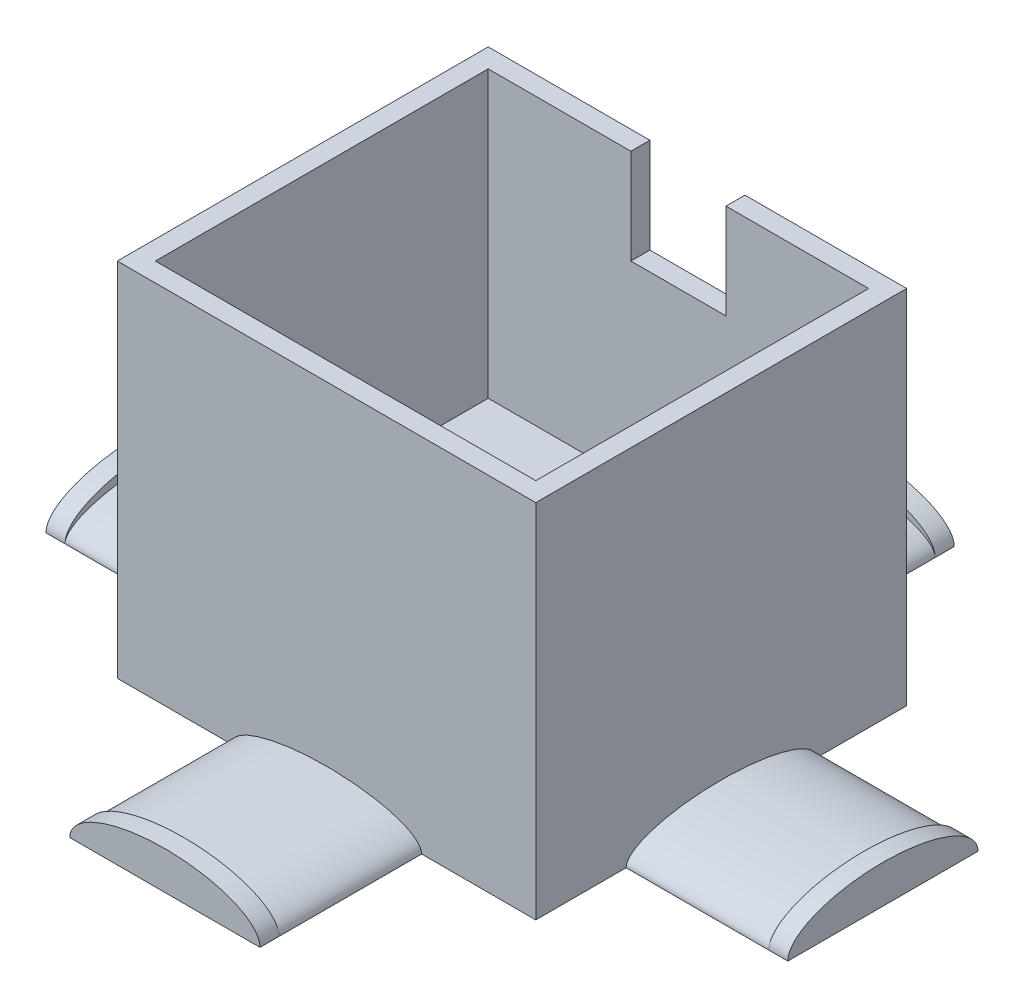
SolidWorks part; units mm, degrees
ref_plane "Front Plane" through (0, 0, 0) normal (0, 0, 1) x (1, 0, 0)
ref_plane "Top Plane" through (0, 0, 0) normal (0, 1, 0) x (1, 0, 0)
ref_plane "Right Plane" through (0, 0, 0) normal (1, 0, 0) x (0, 0, -1)
sketch "Sketch1" plane through (0, 0, 0) normal (0, 1, 0) x (1, 0, 0)
  line L1 (0, 0) -> (-44, 0)
  line L2 (0, 0) -> (0, 39)
  line L3 (0, 39) -> (-44, 39)
  line L4 (-44, 0) -> (-44, 39)
  dimension "D1" = 39
  dimension "D2" = 44
extrude "Boss-Extrude1" add sketch "Sketch1" along normal blind 32
shell "Shell1" thickness 2
sketch "Sketch2" plane through (0, 0, 0) normal (0, -1, 0) x (1, 0, 0)
  line L1 (-44, 0) -> (0, 0)
  line L2 (-44, 0) -> (-44, -39)
  line L3 (-44, -39) -> (0, -39)
  line L4 (0, 0) -> (0, -39)
extrude "Boss-Extrude2" add sketch "Sketch2" along normal blind 6
sketch "Sketch3" plane through (0, 2, 0) normal (0, 1, 0) x (1, 0, 0)
  line L0 (-22, 37) -> (-22, 27)
  line L1 (-2, 37) -> (-42, 37) construction
  line L2 (-11.205, 27) -> (-32.795, 27)
  line L5 (-32.795, 11.76) -> (-32.795, 27)
  line L6 (-32.795, 11.76) -> (-11.205, 11.76)
  line L7 (-11.205, 11.76) -> (-11.205, 27)
  circle A0 centre (-32.795, 27) radius 1.6
  circle A1 centre (-11.205, 27) radius 1.6
  circle A2 centre (-11.205, 11.76) radius 1.6
  circle A3 centre (-32.795, 11.76) radius 1.6
  point P4 (-22, 29.54)
  point P7 (-22, 27)
  point P14 (-32.795, 19.38)
  dimension "D3" = 3.2
  dimension "D4" = 3.2
  dimension "D5" = 3.2
  dimension "D6" = 3.2
  dimension "D1" = 21.59
  dimension "D2" = 15.24
  dimension "D7" = 10
  dimension "D8" = 2.54
extrude "Cut-Extrude1" cut sketch "Sketch3" against normal through all contours L2 A0 L5 | L5 A0 L2 | L2 A1 L7 | L7 A1 L2 | L7 A2 L6 | L6 A2 L7 | L5 A3 L6 | L6 A3 L5
sketch "Sketch5" plane through (0, 2, 0) normal (0, 1, 0) x (1, 0, 0)
  line L0 (-42, 2) -> (-42, 19)
  line L1 (-42, 37) -> (-42, 2) construction
  line L2 (-42, 19) -> (-2, 19)
  line L3 (-2, 2) -> (-2, 37) construction
  circle A0 centre (-32.025, 19) radius 2
  circle A1 centre (-11.975, 19) radius 2
  point P5 (-32.025, 19)
  point P9 (-11.975, 19)
  point P10 (-22, 19)
  dimension "D4" = 4
  dimension "D5" = 4
  dimension "D1" = 17
  dimension "D2" = 20.05
  dimension "D3" = 10.025
extrude "Cut-Extrude2" cut sketch "Sketch5" against normal through all contours A0 | A1
sketch "Sketch7" plane through (0, 0, 0) normal (0, 0, 1) x (1, 0, 0)
  line L0 (0, -6) -> (-44, -6) construction
  line L1 (-32, -6) -> (-12, -6)
  ellipse E0 centre (-22, -6) end of major axis (-12, -6) minor radius 3
  dimension "D1" = 6
  dimension "D2" = 20
extrude "Boss-Extrude4" add sketch "Sketch7" along normal blind 15 contours E0 M3
sketch "Sketch8" plane through (0, 0, -39) normal (0, 0, -1) x (-1, 0, 0)
  line L0 (44, -6) -> (0, -6) construction
  line L1 (12, -6) -> (32, -6)
  ellipse E0 centre (22, -6) end of major axis (32, -6) minor radius 3
  dimension "D1" = 20
  dimension "D2" = 6
extrude "Boss-Extrude5" add sketch "Sketch8" along normal blind 15 contours E0 M3
sketch "Sketch9" plane through (0, 0, 0) normal (1, 0, 0) x (0, 0, -1)
  line L0 (39, -6) -> (0, -6) construction
  line L1 (9.5, -6) -> (29.5, -6)
  ellipse E0 centre (19.5, -6) end of major axis (29.5, -6) minor radius 3
  dimension "D1" = 20
  dimension "D2" = 6
extrude "Boss-Extrude6" add sketch "Sketch9" along normal blind 15 contours E0 M3
sketch "Sketch10" plane through (-44, 0, 0) normal (-1, 0, 0) x (0, 0, 1)
  line L0 (0, -6) -> (-39, -6) construction
  line L1 (-29.5, -6) -> (-9.5, -6)
  ellipse E0 centre (-19.5, -6) end of major axis (-29.5, -6) minor radius 3
  dimension "D1" = 20
  dimension "D2" = 6
extrude "Boss-Extrude7" add sketch "Sketch10" along normal blind 15 contours E0 M3
sketch "Sketch11" plane through (0, 0, -39) normal (0, 0, -1) x (-1, 0, 0)
  line L5 (0, 32) -> (44, 32) construction
  line L7 (17, 32) -> (27, 32)
  line L8 (17, 32) -> (17, 22)
  line L9 (17, 22) -> (27, 22)
  line L10 (27, 32) -> (27, 22)
  point P0 (22, 32)
  point P5 (16.8785, 32)
  point P8 (21.8785, 32)
  dimension "D1" = 10
  dimension "D2" = 10
  dimension "D3" = 5
extrude "Cut-Extrude3" cut sketch "Sketch11" against normal blind 10
sketch "Sketch12" plane through (0, 0, 15) normal (0, 0, 1) x (1, 0, 0)
  line L0 (-32, -6) -> (-12, -6) construction
  line L1 (-32, -6) -> (-12, -6)
  ellipse E0 centre (-22, -6) end of major axis (-12, -6) minor radius 4
  dimension "D1" = 8
extrude "Boss-Extrude8" add sketch "Sketch12" along normal blind 2
sketch "Sketch13" plane through (-59, 0, 0) normal (-1, 0, 0) x (0, 0, 1)
  line L0 (-29.5, -6) -> (-9.5, -6) construction
  line L1 (-29.5, -6) -> (-9.5, -6)
  ellipse E0 centre (-19.5, -6) end of major axis (-29.5, -6) minor radius 4
  dimension "D1" = 8
extrude "Boss-Extrude9" add sketch "Sketch13" along normal blind 2
sketch "Sketch14" plane through (0, 0, -54) normal (0, 0, -1) x (-1, 0, 0)
  line L0 (12, -6) -> (32, -6) construction
  line L1 (12, -6) -> (32, -6)
  ellipse E0 centre (22, -6) end of major axis (32, -6) minor radius 4
  dimension "D1" = 8
extrude "Boss-Extrude10" add sketch "Sketch14" along normal blind 2
sketch "Sketch15" plane through (15, 0, 0) normal (1, 0, 0) x (0, 0, -1)
  line L0 (9.5, -6) -> (29.5, -6) construction
  line L1 (9.5, -6) -> (29.5, -6)
  ellipse E0 centre (19.5, -6) end of major axis (29.5, -6) minor radius 4
  dimension "D1" = 8
extrude "Boss-Extrude11" add sketch "Sketch15" along normal blind 2
